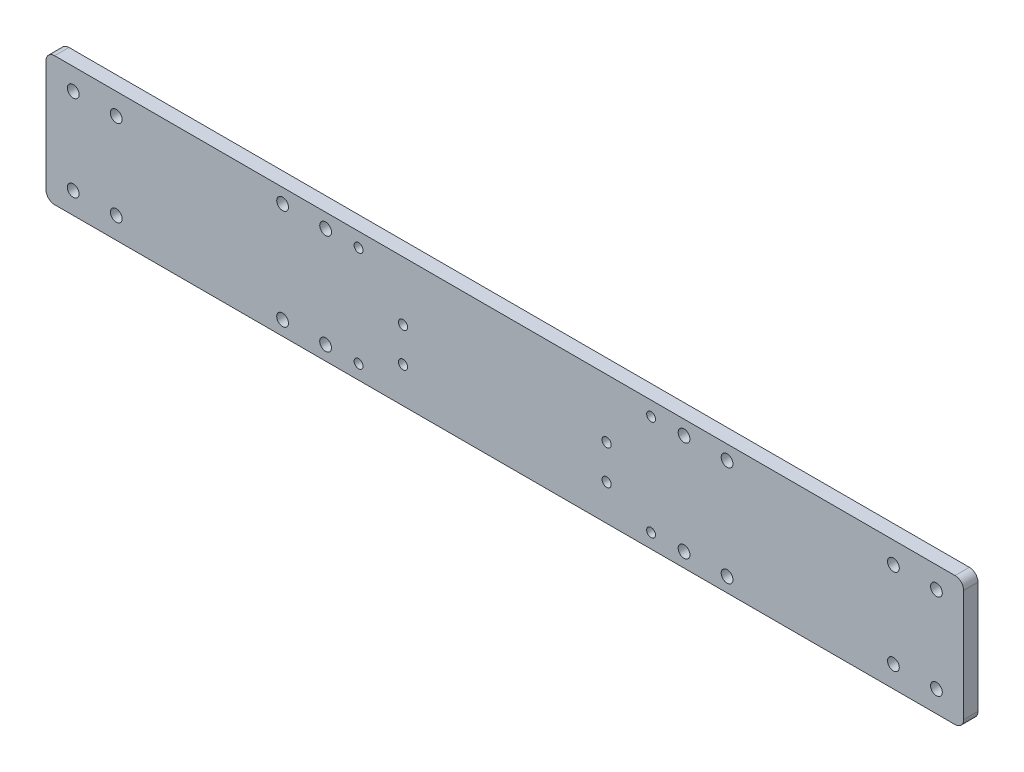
SolidWorks part; units mm, degrees
ref_plane "前视基准面" through (0, 0, 0) normal (0, 0, 1) x (1, 0, 0)
ref_plane "上视基准面" through (0, 0, 0) normal (0, 1, 0) x (1, 0, 0)
ref_plane "右视基准面" through (0, 0, 0) normal (1, 0, 0) x (0, 0, -1)
sketch "草图1" plane through (0, 0, 0) normal (0, 0, 1) x (1, 0, 0)
  line L0 (0, 0) -> (0, 22.5) construction
  line L1 (-160, -22.5) -> (160, -22.5)
  line L2 (-160, -22.5) -> (-160, 22.5)
  line L3 (0, 22.5) -> (160, 22.5)
  line L4 (160, -22.5) -> (160, 22.5)
  line L5 (-160, -22.5) -> (160, 22.5) construction
  line L6 (-160, 22.5) -> (160, -22.5) construction
  line L7 (0, 0) -> (-160, 0) construction
  line L8 (-160, 0) -> (-160, 31.1037) construction
  line L9 (-70, 0) -> (-70, 46.5089) construction
  line L10 (0, 22.5) -> (-160, 22.5)
  line L11 (-62.5, 17.5) -> (-62.5, -17.5) construction
  line L12 (-77.5, 17.5) -> (-77.5, -17.5) construction
  circle A0 centre (-77.5, 17.5) radius 2.05
  circle A1 centre (-62.5, 17.5) radius 2.05
  circle A2 centre (-62.5, -17.5) radius 2.05
  circle A3 centre (-77.5, -17.5) radius 2.05
  circle A4 centre (-150.5, 15) radius 2.05
  circle A5 centre (-135.5, 15) radius 2.05
  circle A6 centre (-135.5, -15) radius 2.05
  circle A7 centre (-150.5, -15) radius 2.05
  circle A8 centre (150.5, 15) radius 2.05
  circle A9 centre (150.5, -15) radius 2.05
  circle A10 centre (135.5, -15) radius 2.05
  circle A11 centre (135.5, 15) radius 2.05
  circle A12 centre (62.5, -17.5) radius 2.05
  circle A13 centre (77.5, -17.5) radius 2.05
  circle A14 centre (62.5, 17.5) radius 2.05
  circle A15 centre (77.5, 17.5) radius 2.05
  point P0 (0, 0)
  point P8 (-70, 0)
  dimension "D3" = 4.1
  dimension "D4" = 15
  dimension "D5" = 35
  dimension "D6" = 2
  dimension "D8" = 30
  dimension "D9" = 9.5
  dimension "D10" = 2
  dimension "D12" = 4.1
  dimension "D1" = 320
  dimension "D2" = 45
  dimension "D13" = 62.5
  dimension "D11" = 2
  dimension "D7" = 2
extrude "凸台-拉伸1" add sketch "草图1" along normal blind 5
sketch "草图2" plane through (0, 0, 5) normal (0, 0, 1) x (1, 0, 0)
  line L0 (-160, 0) -> (160, 0) construction
  line L1 (-160, 22.5) -> (-160, -22.5) construction
  line L2 (160, -22.5) -> (160, 22.5) construction
  line L3 (0, 0) -> (0, 82.8981) construction
  line L4 (160, 22.5) -> (-160, 22.5) construction
  circle A0 centre (-51, 17.5) radius 1.55
  circle A1 centre (51, 17.5) radius 1.55
  circle A2 centre (-51, -17.5) radius 1.55
  circle A3 centre (51, -17.5) radius 1.55
  dimension "D1" = 3.1
  dimension "D2" = 5
  dimension "D3" = 102
  dimension "D4" = 2
  dimension "D5" = 1
extrude "切除-拉伸1" cut sketch "草图2" against normal blind 10
sketch "草图3" plane through (0, 0, 5) normal (0, 0, 1) x (1, 0, 0)
  line L0 (0, 0) -> (0, 73.1923) construction
  line L1 (0, 0) -> (-82.335, 0) construction
  circle A0 centre (-35.5, 2) radius 1.6
  circle A1 centre (35.5, 2) radius 1.6
  circle A2 centre (35.5, -10) radius 1.6
  circle A3 centre (-35.5, -10) radius 1.6
  dimension "D1" = 3.2
  dimension "D2" = 71
  dimension "D3" = 2
  dimension "D4" = 2
  dimension "D5" = 2
extrude "切除-拉伸2" cut sketch "草图3" against normal blind 10
fillet "圆角1" radius 3 4 edges at (-160, 22.5, 2.5) (-160, -22.5, 2.5) (160, -22.5, 2.5) (160, 22.5, 2.5)
